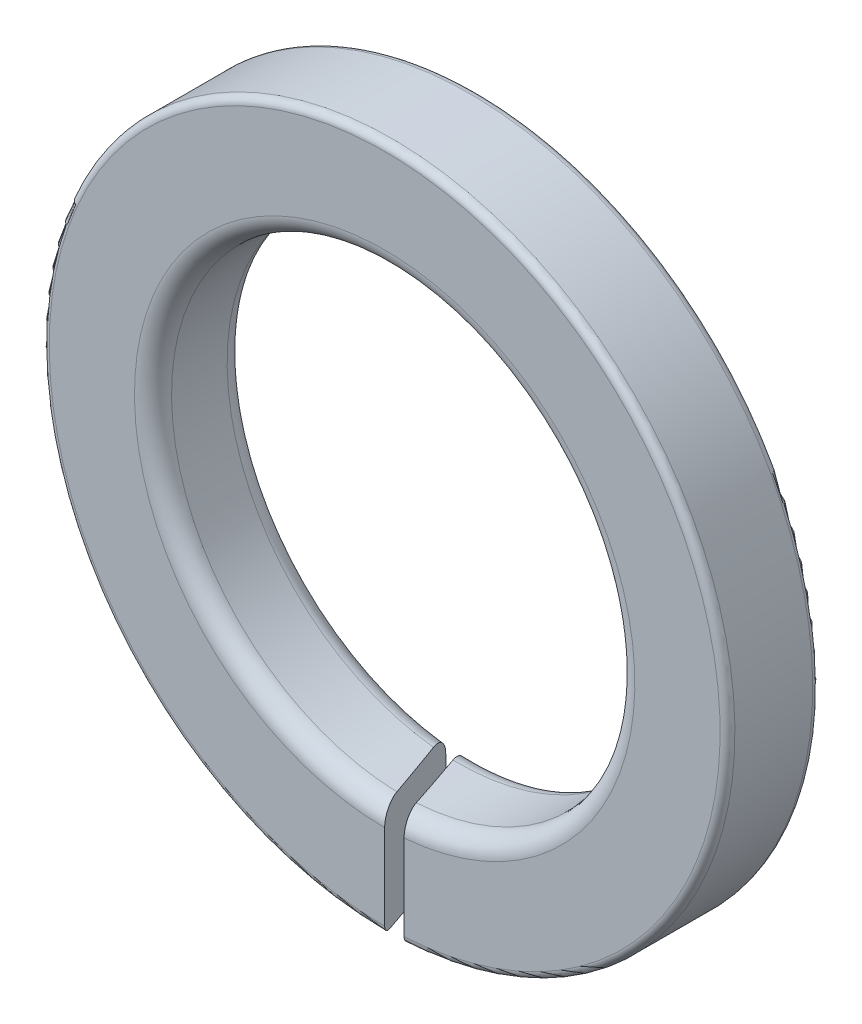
SolidWorks part; units mm, degrees
ref_plane "Plan de face" through (0, 0, 0) normal (0, 0, 1) x (1, 0, 0)
ref_plane "Plan de dessus" through (0, 0, 0) normal (0, 1, 0) x (1, 0, 0)
ref_plane "Plan de droite" through (0, 0, 0) normal (1, 0, 0) x (0, 0, -1)
sketch "Esquisse1" plane through (0, 0, 0) normal (0, 0, 1) x (1, 0, 0)
  circle A0 centre (0, 0) radius 6.25
  circle A1 centre (0, 0) radius 9.25
  dimension "D1" = 18.5
  dimension "D2" = 12.5
extrude "Extrusion1" add sketch "Esquisse1" along normal blind 2.5
sketch "Esquisse2" plane through (0, 0, 0) normal (0, 1, 0) x (1, 0, 0)
  line L0 (-0.8517, 0) -> (0, -2.5)
  line L1 (9.25, 0) -> (-9.25, 0) construction
  line L2 (-9.25, -2.5) -> (9.25, -2.5) construction
  line L3 (0.5246, -2.5) -> (-0.327, 0)
  line L4 (-0.8517, 0) -> (-0.327, 0)
  line L5 (0, -2.5) -> (0.5246, -2.5)
  dimension "D1" = 0.4966
extrude "Enlèv. mat.-Extru.1" cut sketch "Esquisse2" against normal through all
fillet "Congé1" radius 0.5 2 edges at (-0.2625, 6.2445, 2.5) (0.5899, 6.2221, 0)
fillet "Congé2" radius 0.2 2 edges at (-0.2624, 9.2463, 2.5) (0.5896, 9.2312, 0)
